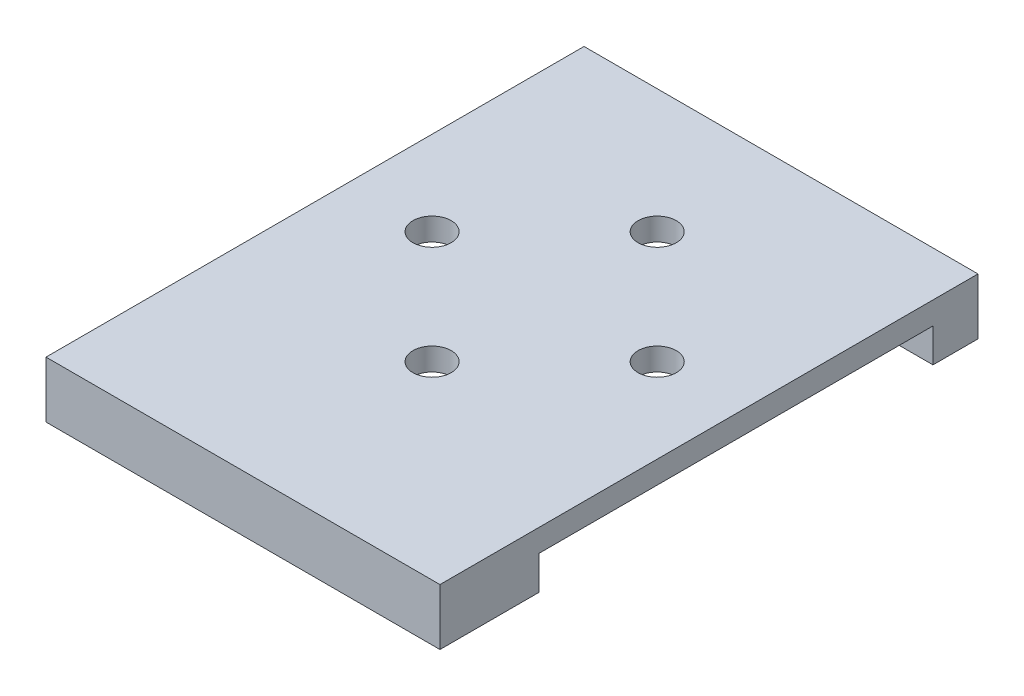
SolidWorks part; units mm, degrees
ref_plane "Front" through (0, 0, 0) normal (0, 0, 1) x (1, 0, 0)
ref_plane "Top" through (0, 0, 0) normal (0, 1, 0) x (1, 0, 0)
ref_plane "Right" through (0, 0, 0) normal (1, 0, 0) x (0, 0, -1)
sketch "Sketch1" plane through (0, 0, 0) normal (0, 1, 0) x (1, 0, 0)
  line L1 (17.5, -23.9) -> (-17.5, -23.9)
  line L2 (17.5, -23.9) -> (17.5, 23.9)
  line L3 (17.5, 23.9) -> (-17.5, 23.9)
  line L4 (-17.5, -23.9) -> (-17.5, 23.9)
  line L5 (17.5, -23.9) -> (-17.5, 23.9) construction
  line L6 (17.5, 23.9) -> (-17.5, -23.9) construction
  point P0 (0, 0)
  dimension "D1" = 35
  dimension "D2" = 47.8
extrude "Boss-Extrude1" add sketch "Sketch1" along normal blind 5
sketch "Sketch2" plane through (0, 5, 0) normal (0, 1, 0) x (1, 0, 0)
  line L0 (0, -50) -> (0, 50) construction
  line L1 (0, 12.9) -> (0, -7.1) construction
  line L2 (17.5, 23.9) -> (-17.5, 23.9) construction
  line L3 (-10, 2.9) -> (10, 2.9) construction
  circle A0 centre (0, 12.9) radius 1.7
  circle A1 centre (0, -7.1) radius 1.7
  circle A2 centre (10, 2.9) radius 1.7
  circle A3 centre (-10, 2.9) radius 1.7
  point P12 (0, 2.9)
  point P13 (0, 2.9)
  dimension "D1" = 3.4
  dimension "D2" = 3.4
  dimension "D3" = 20
  dimension "D4" = 11
  dimension "D5" = 20
  dimension "D6" = 0
extrude "Cut-Extrude1" cut sketch "Sketch2" against normal through all
sketch "Sketch3" plane through (-17.5, 0, 0) normal (-1, 0, 0) x (0, 0, 1)
  line L0 (50, 0) -> (-50, 0) construction
  line L1 (-19.9, 0) -> (15.1, 0)
  line L2 (-19.9, 0) -> (-19.9, 3)
  line L3 (-19.9, 3) -> (15.1, 3)
  line L4 (15.1, 0) -> (15.1, 3)
  dimension "D1" = 35
  dimension "D2" = 3
  dimension "D3" = 4
extrude "Cut-Extrude2" cut sketch "Sketch3" against normal through all
